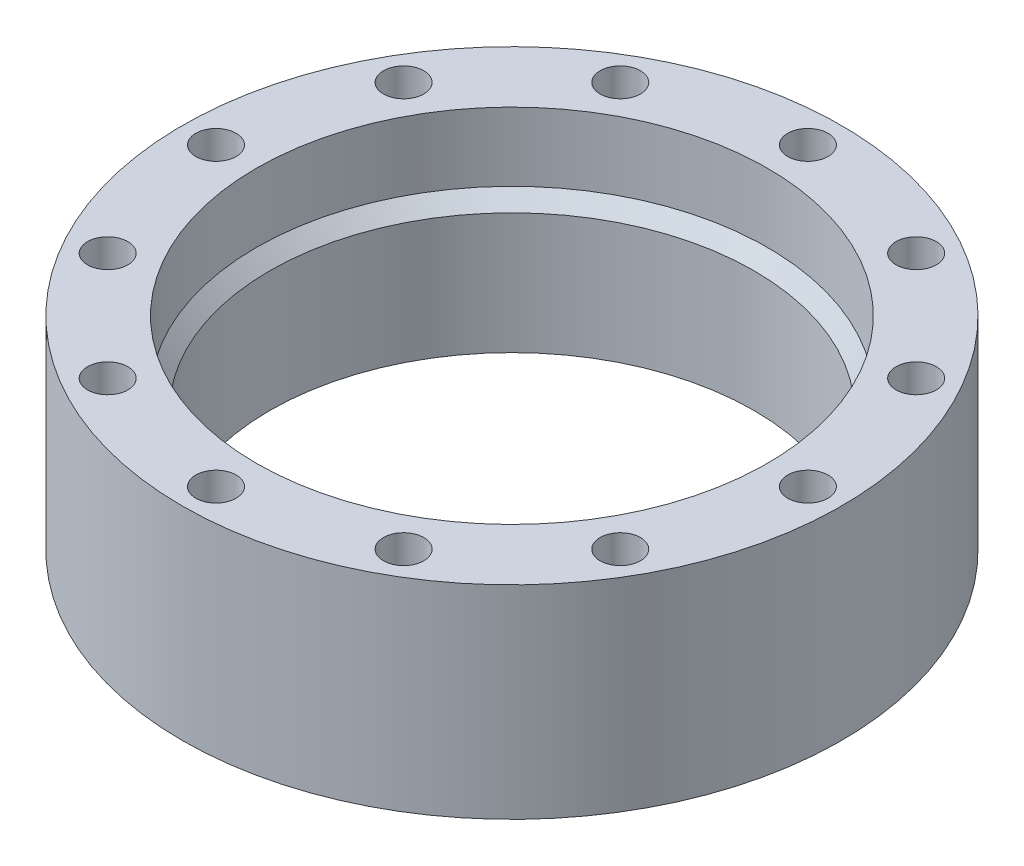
SolidWorks part; units mm, degrees
ref_plane "Alzado" through (0, 0, 0) normal (0, 0, 1) x (1, 0, 0)
ref_plane "Planta" through (0, 0, 0) normal (0, 1, 0) x (1, 0, 0)
ref_plane "Vista lateral" through (0, 0, 0) normal (1, 0, 0) x (0, 0, -1)
sketch "Sketch1" plane through (0, 0, 0) normal (0, 1, 0) x (1, 0, 0)
  circle A0 centre (0, 0) radius 24.5
  circle A1 centre (0, 0) radius 19
  dimension "D1" = 38
  dimension "D2" = 49
extrude "Boss-Extrude1" add sketch "Sketch1" along normal blind 15.1
sketch "Sketch2" plane through (0, 15.1, 0) normal (0, 1, 0) x (1, 0, 0)
  line L0 (0, 22) -> (0, 0) construction
  circle A0 centre (0, 22) radius 1.5
  circle A1 centre (11, 19.0526) radius 1.5
  circle A2 centre (19.0526, 11) radius 1.5
  circle A3 centre (22, 0) radius 1.5
  circle A4 centre (19.0526, -11) radius 1.5
  circle A5 centre (11, -19.0526) radius 1.5
  circle A6 centre (0, -22) radius 1.5
  circle A7 centre (-11, -19.0526) radius 1.5
  circle A8 centre (-19.0526, -11) radius 1.5
  circle A9 centre (-22, 0) radius 1.5
  circle A10 centre (-19.0526, 11) radius 1.5
  circle A11 centre (-11, 19.0526) radius 1.5
  dimension "D1" = 3
  dimension "D2" = 22
  dimension "D3" = 12
extrude "Cut-Extrude1" cut sketch "Sketch2" against normal blind 7
sketch "Sketch3" plane through (0, 0, 0) normal (0, 0, 1) x (1, 0, 0)
  line L0 (18, 0) -> (18, 9)
  line L1 (-24.5, 0) -> (24.5, 0) construction
  line L2 (18, 9) -> (19, 10)
  line L3 (19, 10) -> (19, 0)
  line L4 (19, 0) -> (18, 0)
  line L6 (0, 0) -> (0, 15.1) construction
  line L7 (1.5, 15.1) -> (-1.5, 15.1) construction
  dimension "D1" = 45
  dimension "D2" = 19
  dimension "D3" = 9
  dimension "D4" = 18
revolve "Revolve1" add sketch "Sketch3" angle 360 about L6
